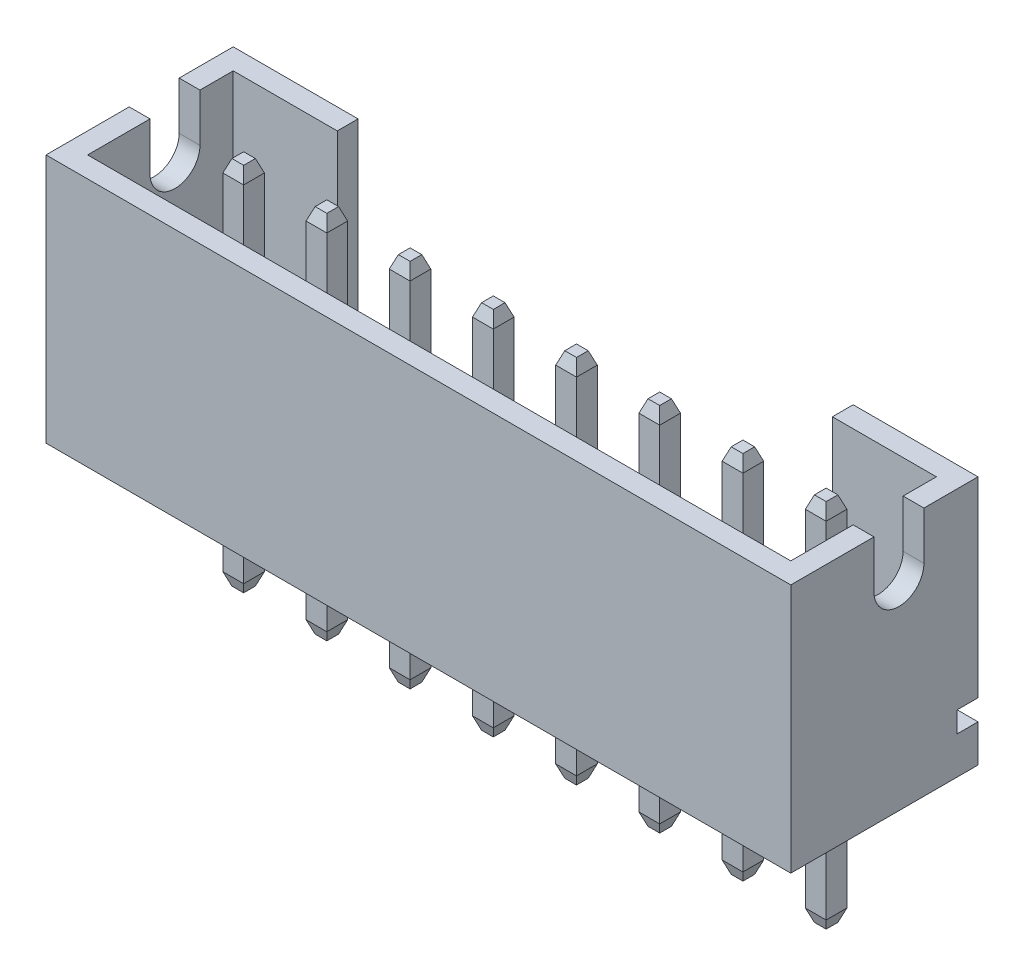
SolidWorks part; units mm, degrees
ref_plane "Front" through (0, 0, 0) normal (0, 0, 1) x (1, 0, 0)
ref_plane "Top" through (0, 0, 0) normal (0, 1, 0) x (1, 0, 0)
ref_plane "Right" through (0, 0, 0) normal (1, 0, 0) x (0, 0, -1)
sketch "Эскиз3" plane through (0, 0, 0) normal (1, 0, 0) x (0, 0, -1)
  line L0 (-2.8, 0) -> (1.7, 0)
  line L1 (1.7, 0) -> (1.7, 0.9)
  line L2 (1.7, 6) -> (0.4, 6)
  line L3 (0.4, 6) -> (0.4, 4.85)
  line L4 (-0.8, 4.85) -> (-0.8, 6)
  line L5 (-0.8, 6) -> (-2.8, 6)
  line L6 (-2.8, 6) -> (-2.8, 0)
  line L7 (1.7, 1.4) -> (1.7, 6)
  line L8 (1.7, 0.9) -> (1.2, 0.9)
  line L10 (1.7, 1.4) -> (1.2, 1.4)
  line L11 (1.2, 0.9) -> (1.2, 1.4)
  arc A0 (0.4, 4.85) -> (-0.8, 4.85) centre (-0.2, 4.85) cw
  dimension "D8" = 1.75
  dimension "D1" = 1.7
  dimension "D2" = 4.5
  dimension "D3" = 6
  dimension "D4" = 0.9
  dimension "D5" = 0.5
  dimension "D6" = 1.2
  dimension "D7" = 1.3
extrude "Вытянуть3" add sketch "Эскиз3" against normal blind 1.95 and the other way blind 15.95
sketch "Эскиз4" plane through (0, 6, 0) normal (0, 1, 0) x (-1, 0, 0)
  line L0 (1.95, -1.7) -> (-15.95, -1.7) construction
  line L1 (-12.95, -1.2) -> (-15.45, -1.2)
  line L2 (1.45, -1.2) -> (-1.05, -1.2)
  line L3 (1.45, -1.2) -> (1.45, 2.3)
  line L4 (1.45, 2.3) -> (-15.45, 2.3)
  line L5 (-1.05, -1.7) -> (-12.95, -1.7)
  line L6 (-1.05, -1.7) -> (-1.05, -1.2)
  line L7 (1.95, -1.7) -> (1.95, -0.4) construction
  line L8 (-12.95, -1.7) -> (-12.95, -1.2)
  line L9 (-15.45, -1.2) -> (-15.45, 2.3)
  line L10 (-15.95, -1.7) -> (-15.95, -0.4) construction
  line L11 (1.95, 2.8) -> (-15.95, 2.8) construction
  line L12 (-7, -1.7) -> (-7, 2.8) construction
  dimension "D1" = 0.5
  dimension "D2" = 0.5
  dimension "D3" = 0.5
  dimension "D4" = 0.5
  dimension "D5" = 3
extrude "Вырез-Вытянуть1" cut sketch "Эскиз4" against normal offset from surface (4 mm away) 2
sketch "Эскиз1" plane through (0, 0, 0) normal (0, 1, 0) x (1, 0, 0)
  line L0 (0, -0.25) -> (0, 0.25) construction
  line L1 (-0.25, -0.25) -> (0.25, -0.25)
  line L2 (-0.25, -0.25) -> (-0.25, 0.25)
  line L3 (-0.25, 0.25) -> (0.25, 0.25)
  line L4 (0.25, -0.25) -> (0.25, 0.25)
  dimension "D1" = 0.5
extrude "Вытянуть4" add sketch "Эскиз1" against normal blind 3.4 and the other way blind 5.5
chamfer "Фаска1" distance 0.3 angle 20 4 edges at (0, 5.5, -0.25) (0.25, 5.5, 0) (0, 5.5, 0.25) (-0.25, 5.5, 0)
chamfer "Фаска2" distance 0.3 angle 20 4 edges at (0, -3.4, 0.25) (0.25, -3.4, 0) (0, -3.4, -0.25) (-0.25, -3.4, 0)
pattern_linear "Линейный массив3" count 8 spacing 2 along (1, 0, 0) of "Вытянуть4", "Фаска1", "Фаска2"
